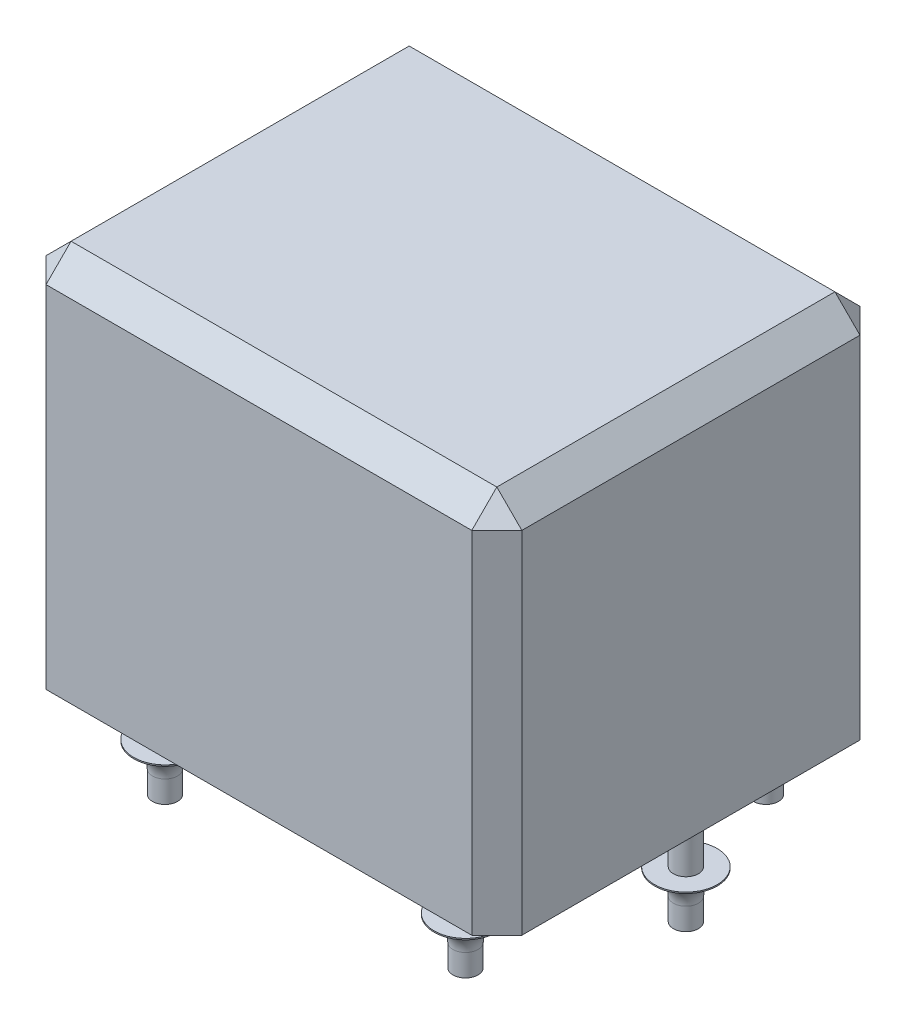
SolidWorks part; units mm, degrees
ref_plane "Plan de face" through (0, 0, 0) normal (0, 0, 1) x (1, 0, 0)
ref_plane "Plan de dessus" through (0, 0, 0) normal (0, 1, 0) x (1, 0, 0)
ref_plane "Plan de droite" through (0, 0, 0) normal (1, 0, 0) x (0, 0, -1)
sketch "Esquisse1" plane through (0, 0, 0) normal (0, 0, 1) x (1, 0, 0)
  line L1 (-9.5, 15) -> (9.5, 15)
  line L2 (-9.5, 15) -> (-9.5, 0)
  line L3 (-9.5, 0) -> (9.5, 0)
  line L4 (9.5, 15) -> (9.5, 0)
  line L5 (-9.5, 15) -> (9.5, 0) construction
  line L6 (-9.5, 0) -> (9.5, 15) construction
  point P0 (0, 7.5)
  dimension "D1" = 19
  dimension "D2" = 15
extrude "Boss.-Extru.1" add sketch "Esquisse1" along normal mid plane 15.5
chamfer "Chanfrein1" distance 1 angle 45 8 edges at (9.5, 15, 0) (0, 15, 7.75) (-9.5, 15, 0) (0, 15, -7.75) (9.5, 7.5, 7.75) (9.5, 7.5, -7.75) (-9.5, 7.5, -7.75) (-9.5, 7.5, 7.75)
sketch "Esquisse2" plane through (0, 0, 0) normal (0, -1, 0) x (1, 0, 0)
  circle A0 centre (6, 5.5) radius 0.5
  dimension "D1" = 5.5
  dimension "D2" = 6
extrude "Boss.-Extru.2" add sketch "Esquisse2" along normal blind 3.5 separate body
ref_plane "Plan1" through (0, -1.6, 0) normal (0, 1, 0) x (1, 0, 0)
sketch "Esquisse3" plane through (0, -1.6, 0) normal (0, 1, 0) x (1, 0, 0)
  circle A0 centre (6, -5.5) radius 1.25
extrude "Boss.-Extru.3" add sketch "Esquisse3" against normal blind 0.05
fillet "Congé1" radius 1 1 edges at (6, -1.65, 6)
pattern_linear "Répétition linéaire2" count 2 spacing 12 along (-1, 0, 0) count 2 spacing 12 along (0, 0, -1)
pattern_linear "Répétition linéaire3" count 2 spacing 2.8 along (1, 0, 0) count 2 spacing 6 along (0, 0, -1)
